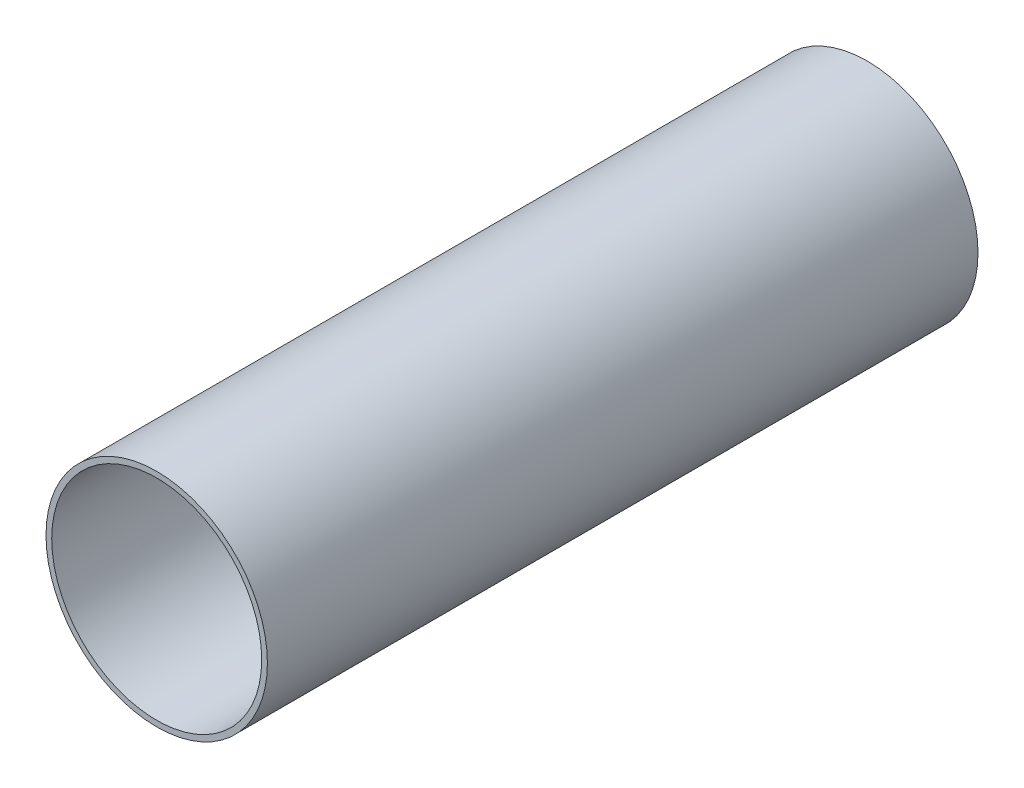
SolidWorks part; units mm, degrees
ref_plane "Front Plane" through (0, 0, 0) normal (0, 0, 1) x (1, 0, 0)
ref_plane "Top Plane" through (0, 0, 0) normal (0, 1, 0) x (1, 0, 0)
ref_plane "Right Plane" through (0, 0, 0) normal (1, 0, 0) x (0, 0, -1)
sketch "Sketch1" plane through (0, 0, 0) normal (0, 0, 1) x (1, 0, 0)
  circle A0 centre (0, 0) radius 40.64
  circle A1 centre (0, 0) radius 38.5445
  dimension "D1" = 81.28
  dimension "D2" = 77.089
extrude "Boss-Extrude1" add sketch "Sketch1" along normal blind 257.81
sketch "Sketch2" plane through (0, 0, 0) normal (0, 0, -1) x (-1, 0, 0)
  circle A0 centre (0, 0) radius 40.64
  circle A1 centre (0, 0) radius 24.13
  dimension "D1" = 48.26
extrude "Boss-Extrude2" add sketch "Sketch2" along normal blind 3.048
